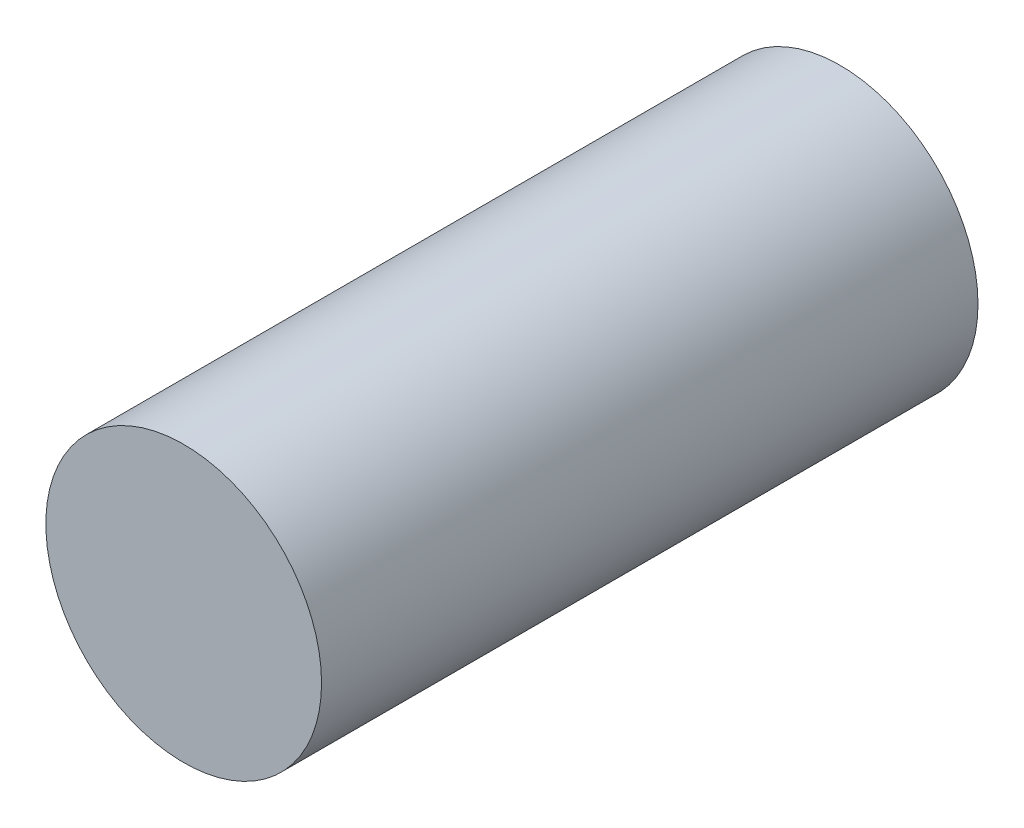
SolidWorks part; units mm, degrees
ref_plane "Alzado" through (0, 0, 0) normal (0, 0, 1) x (1, 0, 0)
ref_plane "Planta" through (0, 0, 0) normal (0, 1, 0) x (1, 0, 0)
ref_plane "Vista lateral" through (0, 0, 0) normal (1, 0, 0) x (0, 0, -1)
sketch "Croquis1" plane through (0, 0, 0) normal (0, 0, 1) x (1, 0, 0)
  circle A0 centre (0, 0) radius 10.5
  dimension "D1" = 21
extrude "Saliente-Extruir1" add sketch "Croquis1" along normal blind 50
